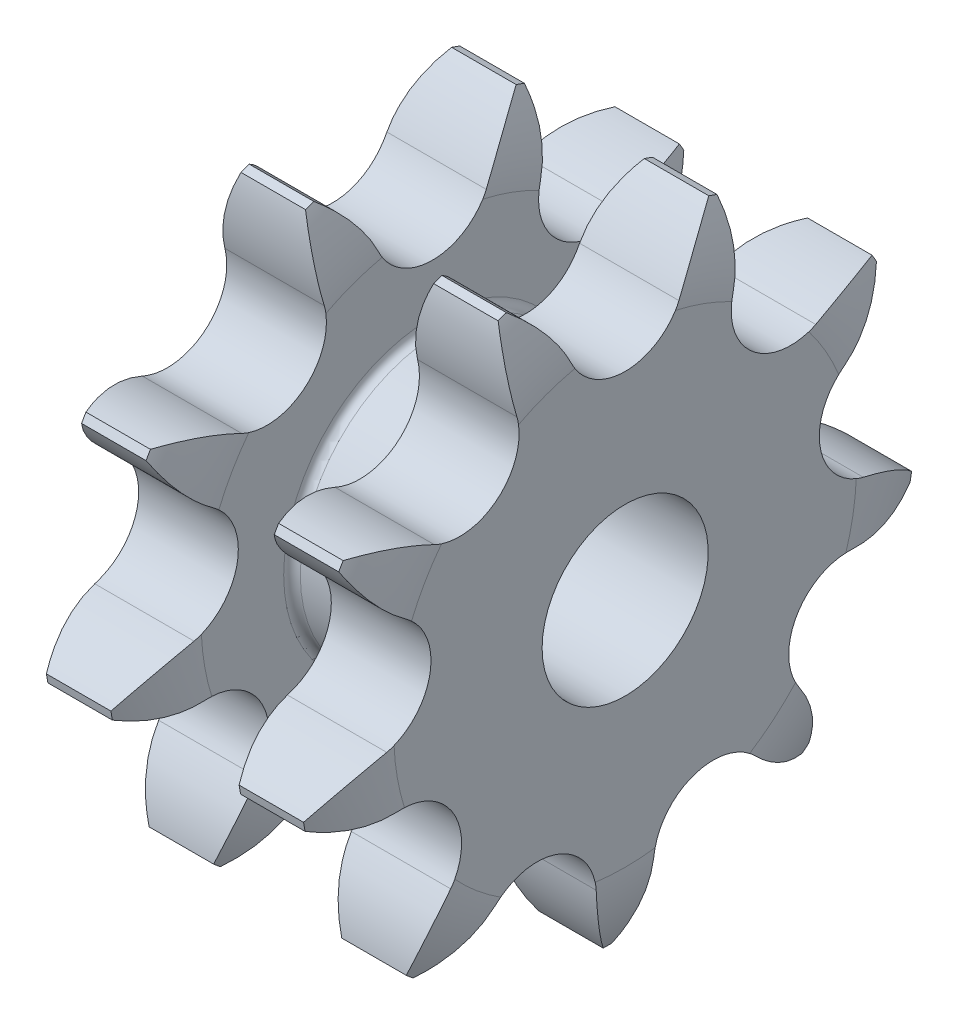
SolidWorks part; units mm, degrees
ref_plane "Plane1" through (0, 0, 0) normal (0, 0, 1) x (1, 0, 0)
ref_plane "Plane2" through (0, 0, 0) normal (0, 1, 0) x (1, 0, 0)
ref_plane "Plane3" through (0, 0, 0) normal (1, 0, 0) x (0, 0, -1)
sketch "Clipboard" plane through (0, 0, 0) normal (0, 1, 0) x (1, 0, 0)
  line L0 (0, 0) -> (12.5436, -1.9867)
  line L1 (-15, 0) -> (100, 0) construction
  line L2 (0, 0) -> (-0.8416, 0.9512)
  line L3 (0, 0) -> (-11.863, 4.5341)
  line L4 (0, 0) -> (3.0618, 0.4849)
  line L5 (0, 0) -> (-2.8109, -1.0484)
  line L6 (0, 0) -> (-17.5077, -11.8125)
  line L7 (-0.8416, 0.9512) -> (22.0505, 5.4009)
  line L8 (-76.2, 38.1) -> (-75.2, 38.1)
  line L9 (-73.4259, 41.6592) -> (-72.8306, 41.7344)
  line L10 (-73.4741, 12.7512) -> (-59.5541, 12.7512)
  circle A0 centre (0, 0) radius 4.255
  circle A1 centre (0, 0) radius 10.1515
  circle A2 centre (0, 0) radius 25
sketch "BasProSke" plane through (0, 0, 0) normal (0, 1, 0) x (1, 0, 0)
  line L0 (-10, 0) -> (60, 0) construction
  line L1 (0, 0) -> (0, 16.7129)
  line L2 (0, 0) -> (21.12, 0)
  line L3 (21.12, 0) -> (21.12, 16.7129)
  line L4 (19.85, 22.2487) -> (1.27, 22.2487)
  arc A0 (0, 16.7129) -> (1.27, 22.2487) centre (12.7, 16.7129) cw
  arc A1 (21.12, 16.7129) -> (19.85, 22.2487) centre (8.42, 16.7129) ccw
revolve "Base-Revolve" add sketch "BasProSke" angle 360 about L0
sketch "GrvSke" plane through (0, 0, 0) normal (0, 1, 0) x (1, 0, 0)
  line L0 (7.2, 16.7129) -> (7.2, 10.7515)
  line L1 (7.8, 10.1515) -> (13.32, 10.1515)
  line L2 (13.92, 10.7515) -> (13.92, 16.7129)
  line L3 (5.93, 22.2487) -> (15.19, 22.2487)
  line L4 (10.56, 0) -> (10.56, 52.07) construction
  line L5 (-10, 0) -> (60, 0) construction
  line L6 (0, 0) -> (35.56, 0) construction
  arc A0 (13.92, 16.7129) -> (15.19, 22.2487) centre (26.62, 16.7129) cw
  arc A1 (7.2, 16.7129) -> (5.93, 22.2487) centre (-5.5, 16.7129) ccw
  arc A2 (7.2, 10.7515) -> (7.8, 10.1515) centre (7.8, 10.7515) ccw
  arc A3 (13.32, 10.1515) -> (13.92, 10.7515) centre (13.32, 10.7515) ccw
revolve "Groove" cut sketch "GrvSke" angle 360 about L6
sketch "TooCutSke" plane through (0, 0, 0) normal (1, 0, 0) x (0, 0, -1)
  line L0 (0, 18.6087) -> (3.8949, 16.7925) construction
  line L1 (0, 0) -> (0, 107) construction
  line L2 (0, 18.6087) -> (-10, 18.6087) construction
  line L3 (0, 18.6087) -> (-3.8949, 16.7925) construction
  arc A0 (3.8949, 16.7925) -> (7.8075, 21.3669) centre (14.0756, 12.0451) cw
  arc A1 (3.8949, 16.7925) -> (-3.8949, 16.7925) centre (0, 18.6087) cw
  arc A2 (-3.8949, 16.7925) -> (-7.8075, 21.3669) centre (-14.0756, 12.0451) ccw
  arc A3 (7.8075, 21.3669) -> (-7.8075, 21.3669) centre (0, 0) ccw
extrude "ToothCut" cut sketch "TooCutSke" along normal through all
pattern_circular "TeethCuts" count 9 every 40 about axis through (-10, 0, 0) along (1, 0, 0) of "ToothCut"
sketch "HubNeaOneSke" plane through (0, 0, 0) normal (-1, 0, 0) x (0, 0, 1)
  circle A0 centre (0, 0) radius 10.1515
extrude "HubNearOne" [suppressed] add sketch "HubNeaOneSke" along normal blind 2.2005
fillet "HubNearOneFillet" [suppressed] radius 0.6
sketch "HubNeaBotSke" plane through (0, 0, 0) normal (-1, 0, 0) x (0, 0, 1)
  circle A0 centre (0, 0) radius 10.1515
extrude "HubNearBoth" [suppressed] add sketch "HubNeaBotSke" along normal blind 1.1003
fillet "HubNearBothFillet" [suppressed] radius 0.6
ref_plane "FarPln" through (21.12, 0, 0) normal (1, 0, 0) x (0, 0, -1)
sketch "HubFarSke" plane through (21.12, 0, 0) normal (1, 0, 0) x (0, 0, -1)
  circle A0 centre (0, 0) radius 10.1515
extrude "HubFar" [suppressed] add sketch "HubFarSke" along normal blind 1.1003
fillet "HubFarFillet" [suppressed] radius 0.6
sketch "BorSke" plane through (0, 0, 0) normal (1, 0, 0) x (0, 0, -1)
  circle A0 centre (0, 0) radius 6
extrude "Bore" cut sketch "BorSke" along normal mid plane 46.641
sketch "KeySke" plane through (0, 0, 0) normal (1, 0, 0) x (0, 0, -1)
  line L0 (-1, 0) -> (-1, 7)
  line L1 (-1, 7) -> (1, 7)
  line L2 (1, 7) -> (1, 0)
  line L3 (0, 0) -> (0, 34) construction
  line L4 (-1, 0) -> (1, 0)
extrude "Keyway" [suppressed] cut sketch "KeySke" along normal mid plane 46.641
pattern_circular "Keyway2" [suppressed] count 2 every 90 about axis through (-10, 0, 0) along (1, 0, 0)
equation "' \"Pitch@Clipboard\" = 12.7"
equation "' \"Num_strands@Clipboard\" = 2"
equation "' \"Num_teeth@Clipboard\" = 9"
equation "' \"Hub_dia@Clipboard\" = 50"
equation "' \"Overall_len@Clipboard\" = 3"
equation "' \"Diameter@BorSke\" = 12"
equation "' \"T_dim@Clipboard\" = 1"
equation "' \"Width@KeySke\" = 2"
equation "' \"Dr@Clipboard\" = 8.51"
equation "' \"Face_width@Clipboard\" = 7.2"
equation "' \"Side_radius@Clipboard\" = 12.7"
equation "' \"Side_relief@Clipboard\" = 1.27"
equation "' \"Transv_pitch@Clipboard\" = 13.92"
equation "' \"Show_teeth@Clipboard\" = 9"
equation "' \"Fillet_rad@Clipboard\" = 0.6"
equation "' \"Plate_wid@Clipboard\" = 11.8"
equation "\"Num_teeth@Clipboard\" = int( \"Num_teeth@Clipboard\" )"
equation "\"Num_teeth@Clipboard\" = ((sgn( \"Num_teeth@Clipboard\" - 5.0)+1)*( \"Num_teeth@Clipboard\" - 5.0))/2 +5.0"
equation "\"Num_teeth@Clipboard\" = ((sgn( \"Num_teeth@Clipboard\" - 200.0)-1)*( \"Num_teeth@Clipboard\" - 200.0))/-2 +200.0"
equation "\"MHD@Clipboard\" = \"Pitch@Clipboard\" * (1.0 / tan(3.14159265 / \"Num_teeth@Clipboard\" )) - 1.05 * \"Plate_wid@Clipboard\" - 2.0 * \"Fillet_rad@Clipboard\" - 1.0"
equation "\"Thickness@Clipboard\"  = \"Face_width@Clipboard\" + (\"Num_strands@Clipboard\" - 1) * \"Transv_pitch@Clipboard\""
equation "\"OAL@Clipboard\" = \"Thickness@Clipboard\" + 2 * \"Fillet_rad@Clipboard\" + 1"
equation "\"MHD@Clipboard\" = ((sgn( \"MHD@Clipboard\" - \"Hub_dia@Clipboard\" )-1)*( \"MHD@Clipboard\" - \"Hub_dia@Clipboard\" ))/-2+ \"Hub_dia@Clipboard\""
equation "\"OAL@Clipboard\" = ((sgn( \"OAL@Clipboard\" - \"Overall_len@Clipboard\" )+1)*( \"OAL@Clipboard\" - \"Overall_len@Clipboard\" ))/2 + \"Overall_len@Clipboard\" + 0.0005"
equation "\"Num_teeth@TeethCuts\" = int( \"Show_teeth@Clipboard\" ) + 1"
equation "\"Num_teeth@TeethCuts\" = ((sgn( \"Num_teeth@TeethCuts\" - \"Num_teeth@Clipboard\" )-1)*( \"Num_teeth@TeethCuts\" - \"Num_teeth@Clipboard\" ))/-2+ \"Num_teeth@Clipboard\""
equation "\"Num_teeth@TeethCuts\" = ((sgn( \"Num_teeth@TeethCuts\" - 2.0)+1)*( \"Num_teeth@TeethCuts\" - 2.0))/2 +2.0"
equation "\"Angle@TeethCuts\" = 360.0 / \"Num_teeth@Clipboard\""
equation "\"Seat_radius@TooCutSke\" = ( \"Pitch@Clipboard\" / 2.0) / sin(3.14159265 / \"Num_teeth@Clipboard\" ) - \"Dr@Clipboard\" / 2.0 + \"Dr@Clipboard\" * 0.505"
equation "\"R1@TooCutSke\"  = \"Dr@Clipboard\" * 0.505"
equation "\"X@TooCutSke\" = 140.0 - (90.0 / \"Num_teeth@Clipboard\")"
equation "\"R2@TooCutSke\" = 0.12 * \"Dr@Clipboard\" * ( \"Num_teeth@Clipboard\" + 2.0)"
equation "\"Overcut@TooCutSke\" = 0.5 + 0.625 * \"Pitch@Clipboard\" - 0.5 * \"Dr@Clipboard\"  +  \"Pitch@Clipboard\" / 2.0 / sin(3.14159265 / \"Num_teeth@Clipboard\" )"
equation "\"Diameter@BasProSke\" = 2.0 * ( 0.625 * \"Pitch@Clipboard\" - 0.5 * \"Dr@Clipboard\"  +  \"Pitch@Clipboard\" / 2.0 / sin(3.14159265 / \"Num_teeth@Clipboard\" ))"
equation "\"Thickness@BasProSke\"  = \"Thickness@Clipboard\""
equation "\"G1@BasProSke\" =  \"Side_relief@Clipboard\""
equation "\"G2@BasProSke\" =  \"Side_relief@Clipboard\""
equation "\"D1@BasProSke\" =  \"Side_radius@Clipboard\""
equation "\"Diameter@GrvSke\" = \"Diameter@BasProSke\""
equation "\"G1@GrvSke\" = \"Side_relief@Clipboard\""
equation "\"D1@GrvSke\" = \"Side_radius@Clipboard\""
equation "\"Grv_diam@GrvSke\" =  \"Pitch@Clipboard\" * (1.0 / tan(3.14159265 / \"Num_teeth@Clipboard\" ))- 1.05 * \"Plate_wid@Clipboard\" - 2.0 * \"Fillet_rad@Clipboard\" - 1.0"
equation "\"Grv_width@GrvSke\" =  \"Transv_pitch@Clipboard\" - \"Face_width@Clipboard\""
equation "\"Offset@GrvSke\" = \"Grv_width@GrvSke\" / 2.0 + \"Face_width@Clipboard\""
equation "\"Fillet_rad@GrvSke\" = \"Fillet_rad@Clipboard\""
equation "\"Diameter@HubNeaOneSke\" = \"MHD@Clipboard\""
equation "\"Length@HubNearOne\" = \"OAL@Clipboard\" - \"Thickness@BasProSke\""
equation "\"Diameter@HubNeaBotSke\" = \"MHD@Clipboard\""
equation "\"Length@HubNearBoth\" = ( \"OAL@Clipboard\" - \"Thickness@BasProSke\" ) / 2.0"
equation "\"D1@HubNearOneFillet\" = \"Fillet_rad@Clipboard\""
equation "\"D1@HubNearBothFillet\" = \"Fillet_rad@Clipboard\""
equation "\"Thickness@FarPln\" = \"Thickness@BasProSke\""
equation "\"Diameter@HubFarSke\" = \"MHD@Clipboard\""
equation "\"Length@HubFar\" = ( \"OAL@Clipboard\" - \"Thickness@BasProSke\" ) / 2.0"
equation "\"D1@HubFarFillet\" = \"Fillet_rad@Clipboard\""
equation "\"D1@Bore\" = \"OAL@Clipboard\" * 2.0"
equation "\"D1@Keyway\" = \"OAL@Clipboard\" * 2.0"
equation "\"Offset@KeySke\" = \"T_dim@Clipboard\" + \"Diameter@BorSke\" / 2.0"
